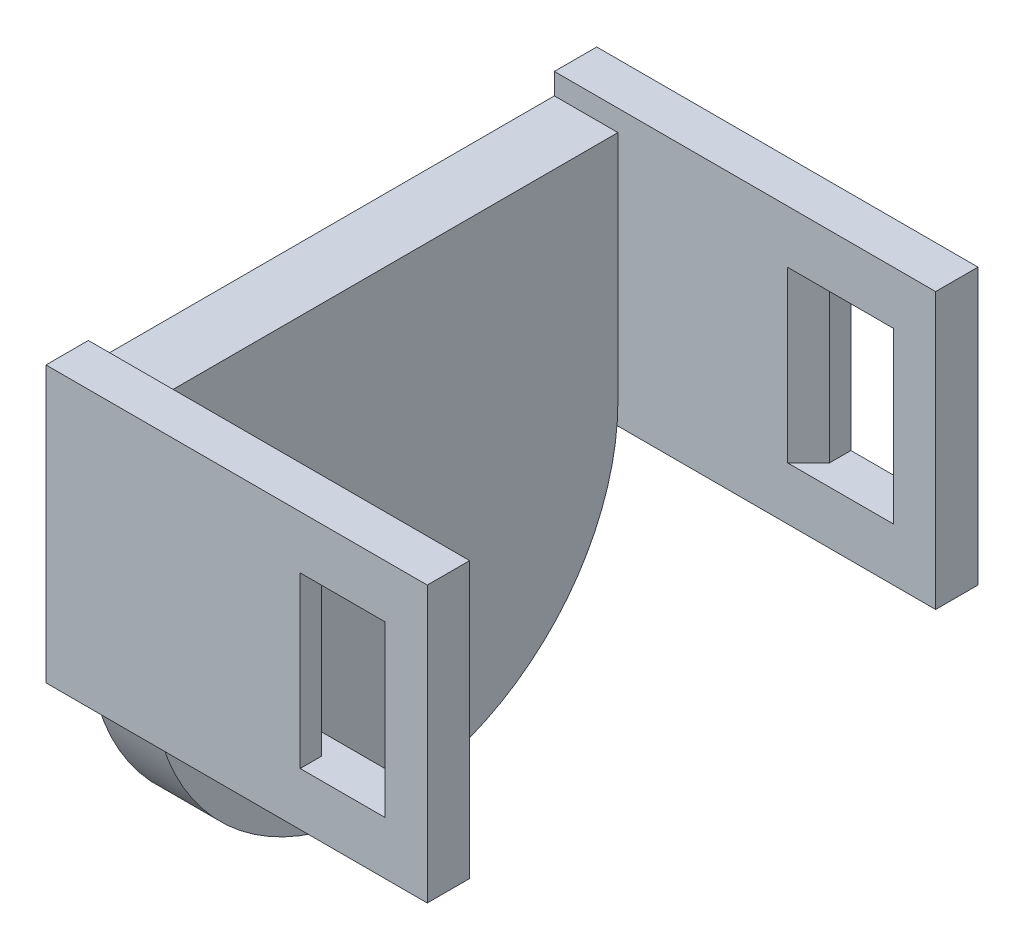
SolidWorks part; units mm, degrees
ref_plane "Front Plane" through (0, 0, 0) normal (0, 0, 1) x (1, 0, 0)
ref_plane "Top Plane" through (0, 0, 0) normal (0, 1, 0) x (1, 0, 0)
ref_plane "Right Plane" through (0, 0, 0) normal (1, 0, 0) x (0, 0, -1)
sketch "Sketch1" plane through (0, 0, 0) normal (1, 0, 0) x (0, 0, -1)
  line L2 (-11, 0) -> (-11, 11)
  line L3 (-11, 11) -> (11, 11)
  line L4 (11, 0) -> (11, 11)
  arc A0 (-11, 0) -> (11, 0) centre (0, 0) ccw
  dimension "D1" = 22
  dimension "D2" = 11
extrude "Boss-Extrude5" add sketch "Sketch1" along normal blind 3
sketch "Sketch9" plane through (0, 0, 11) normal (0, 0, 1) x (1, 0, 0)
  line L1 (0, 11) -> (3, 11)
  line L2 (0, 11) -> (0, 0)
  line L3 (0, 0) -> (3, 0)
  line L4 (3, 11) -> (3, 0)
extrude "Boss-Extrude6" add sketch "Sketch9" along normal blind 2 contours L2 L1 L4 L3
sketch "Sketch10" plane through (0, 0, 0) normal (-1, 0, 0) x (0, 0, 1)
  line L1 (13, 11) -> (11, 11)
  line L2 (13, 11) -> (13, 0)
  line L3 (13, 0) -> (11, 0)
  line L4 (11, 11) -> (11, 0)
sketch "Sketch12" plane through (0, 0, -11) normal (0, 0, -1) x (-1, 0, 0)
  line L1 (-3, 11) -> (0, 11)
  line L2 (-3, 11) -> (-3, 0)
  line L3 (-3, 0) -> (0, 0)
  line L4 (0, 11) -> (0, 0)
extrude "Boss-Extrude8" add sketch "Sketch12" along normal blind 2 contours L2 L1 L4 L3
sketch "Sketch13" plane through (0, 0, 0) normal (-1, 0, 0) x (0, 0, 1)
  line L1 (-13, 11) -> (-11, 11)
  line L2 (-13, 11) -> (-13, 0)
  line L3 (-13, 0) -> (-11, 0)
  line L4 (-11, 11) -> (-11, 0)
sketch "Sketch14" plane through (0, 11, 0) normal (0, 1, 0) x (1, 0, 0)
  line L0 (0, -13) -> (0, -11) construction
  line L1 (3, -13) -> (0, -13)
  line L2 (3, -13) -> (3, -11)
  line L3 (3, -11) -> (0, -11)
  line L4 (0, -13) -> (0, -11)
  line L5 (0, 13) -> (0, -13) construction
  dimension "D1" = 2
extrude "Boss-Extrude12" add sketch "Sketch14" along normal blind 1 contours L2 L1 L4 L3
sketch "Sketch15" plane through (0, 11, 0) normal (0, 1, 0) x (1, 0, 0)
  line L1 (0, 13) -> (3, 13)
  line L2 (0, 13) -> (0, 11)
  line L3 (0, 11) -> (3, 11)
  line L4 (3, 13) -> (3, 11)
extrude "Boss-Extrude13" add sketch "Sketch15" along normal blind 1 contours L2 L1 L4 L3
sketch "Sketch16" plane through (0, 0, 0) normal (0, -1, 0) x (1, 0, 0)
  line L1 (0, -11) -> (3, -11)
  line L2 (0, -11) -> (0, -13)
  line L3 (0, -13) -> (3, -13)
  line L4 (3, -11) -> (3, -13)
extrude "Boss-Extrude14" add sketch "Sketch16" along normal blind 1 contours L2 L1 L4 L3
sketch "Sketch17" plane through (0, 0, 0) normal (0, -1, 0) x (1, 0, 0)
  line L1 (0, 13) -> (3, 13)
  line L2 (0, 13) -> (0, 11)
  line L3 (0, 11) -> (3, 11)
  line L4 (3, 13) -> (3, 11)
extrude "Boss-Extrude15" add sketch "Sketch17" along normal blind 1 contours L2 L1 L4 L3
sketch "Sketch18" plane through (3, 0, 0) normal (1, 0, 0) x (0, 0, -1)
  line L1 (-13, 12) -> (-11, 12)
  line L2 (-13, 12) -> (-13, -1)
  line L3 (-13, -1) -> (-11, -1)
  line L4 (-11, 12) -> (-11, -1)
extrude "Boss-Extrude16" add sketch "Sketch18" along normal blind 15 contours L2 L1 L4 L3
sketch "Sketch19" plane through (3, 0, 0) normal (1, 0, 0) x (0, 0, -1)
  line L1 (11, 12) -> (13, 12)
  line L2 (11, 12) -> (11, -1)
  line L3 (11, -1) -> (13, -1)
  line L4 (13, 12) -> (13, -1)
extrude "Boss-Extrude17" add sketch "Sketch19" along normal blind 15 contours L2 L1 L4 L3
sketch "Sketch20" plane through (0, 0, 13) normal (0, 0, 1) x (1, 0, 0)
  line L0 (18, 12) -> (0, 12) construction
  line L1 (12, 9.5) -> (16, 9.5)
  line L2 (12, 9.5) -> (12, 1.5)
  line L3 (12, 1.5) -> (16, 1.5)
  line L4 (16, 9.5) -> (16, 1.5)
  line L5 (0, -1) -> (18, -1) construction
  line L6 (18, 12) -> (18, -1) construction
  line L7 (3, -11) -> (3, 0) construction
  dimension "D1" = 2.5
  dimension "D2" = 2.5
  dimension "D3" = 2
  dimension "D4" = 9
extrude "Cut-Extrude1" cut sketch "Sketch20" against normal through all contours L2 L1 L4 L3
chamfer "Chamfer2" distance 1 angle 45 1 edges at (12, 5.5, -11)
chamfer "Chamfer3" distance 1 angle 45 1 edges at (12, 5.5, 11)
